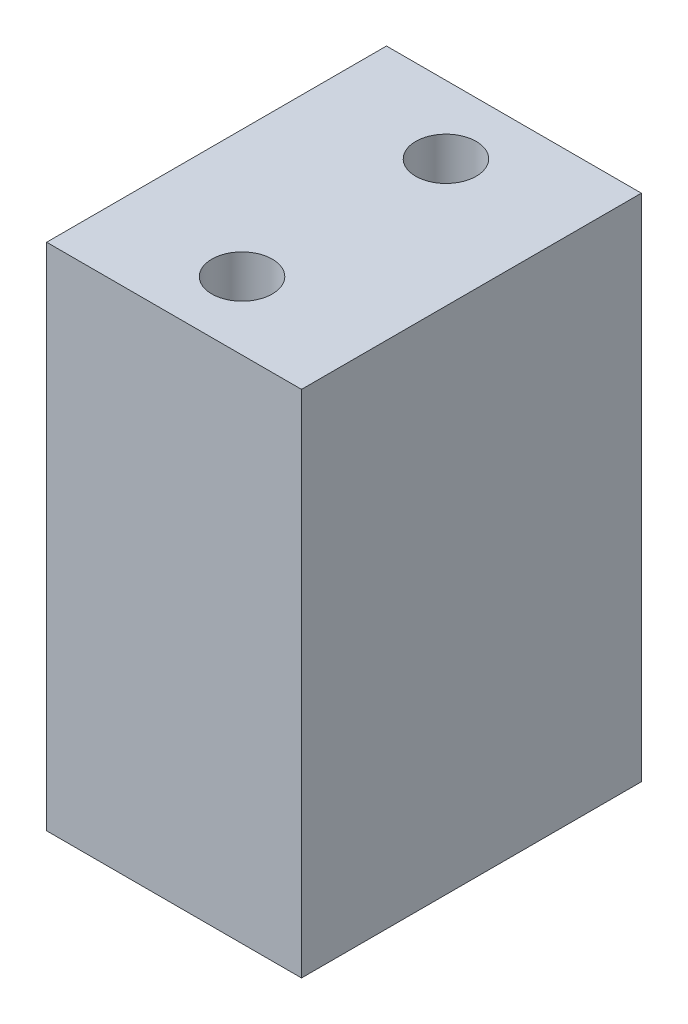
SolidWorks part; units mm, degrees
ref_plane "Front Plane" through (0, 0, 0) normal (0, 0, 1) x (1, 0, 0)
ref_plane "Top Plane" through (0, 0, 0) normal (0, 1, 0) x (1, 0, 0)
ref_plane "Right Plane" through (0, 0, 0) normal (1, 0, 0) x (0, 0, -1)
sketch "Sketch1" plane through (0, 0, 0) normal (0, 0, 1) x (1, 0, 0)
  line L1 (0, 0) -> (9.525, 0)
  line L2 (0, 0) -> (0, 19.05)
  line L3 (0, 19.05) -> (9.525, 19.05)
  line L4 (9.525, 0) -> (9.525, 19.05)
  dimension "D1" = 9.525
  dimension "D2" = 19.05
extrude "Boss-Extrude1" add sketch "Sketch1" along normal blind 12.7
hole_wizard "#4-40 Tapped Hole1" positions "Sketch2" profile "Sketch3" tap size "#4-40" standard "ANSI Inch"
sketch "Sketch2" plane through (0, 19.05, 0) normal (0, 1, 0) x (1, 0, 0)
  line L0 (4.7625, 0) -> (4.7625, -2.54) construction
  line L1 (9.525, 0) -> (0, 0) construction
  line L3 (4.7625, -12.7) -> (4.7625, -10.16) construction
  line L4 (9.525, -12.7) -> (0, -12.7) construction
  point P2 (4.7625, -2.54)
  point P8 (4.7625, -10.16)
  dimension "D1" = 2.54
sketch "Sketch3" plane through (4.7625, 19.05, 10.16) normal (1, 0, 0) x (0, 0, 1)
  line L0 (0, 0) -> (0, 8.2992)
  line L1 (0, 8.2992) -> (1.1303, 7.62)
  line L2 (1.1303, 7.62) -> (1.1303, 0)
  line L5 (1.1303, 0) -> (0, 0)
  line L10 (0, 8.2992) -> (-1.1303, 7.62) construction
  line L11 (0, -6.35) -> (0, 107.95) construction
  dimension "Tap Drill Dia." = 2.2606
  dimension "Tap Drill Depth" = 7.62
  dimension "Drill Angle" = 118
hole_wizard "#4-40 Tapped Hole2" positions "Sketch4" profile "Sketch5" tap size "#4-40" standard "ANSI Inch"
sketch "Sketch4" plane through (0, 0, 0) normal (0, -1, 0) x (1, 0, 0)
  line L0 (0, 0) -> (9.525, 0) construction
  line L1 (0, 12.7) -> (9.525, 12.7) construction
  line L2 (0, 12.7) -> (0, 0) construction
  point P52 (4.7625, 10.795)
  point P54 (4.7625, 1.905)
  dimension "D1" = 1.905
  dimension "D2" = 1.905
  dimension "D3" = 4.7625
  dimension "D4" = 4.7625
sketch "Sketch5" plane through (4.7625, 0, 10.795) normal (1, 0, 0) x (0, 0, -1)
  line L0 (0, 0) -> (0, 8.2992)
  line L1 (0, 8.2992) -> (1.1303, 7.62)
  line L2 (1.1303, 7.62) -> (1.1303, 0)
  line L5 (1.1303, 0) -> (0, 0)
  line L10 (0, 8.2992) -> (-1.1303, 7.62) construction
  line L11 (0, -6.35) -> (0, 107.95) construction
  dimension "Tap Drill Dia." = 2.2606
  dimension "Tap Drill Depth" = 7.62
  dimension "Drill Angle" = 118
